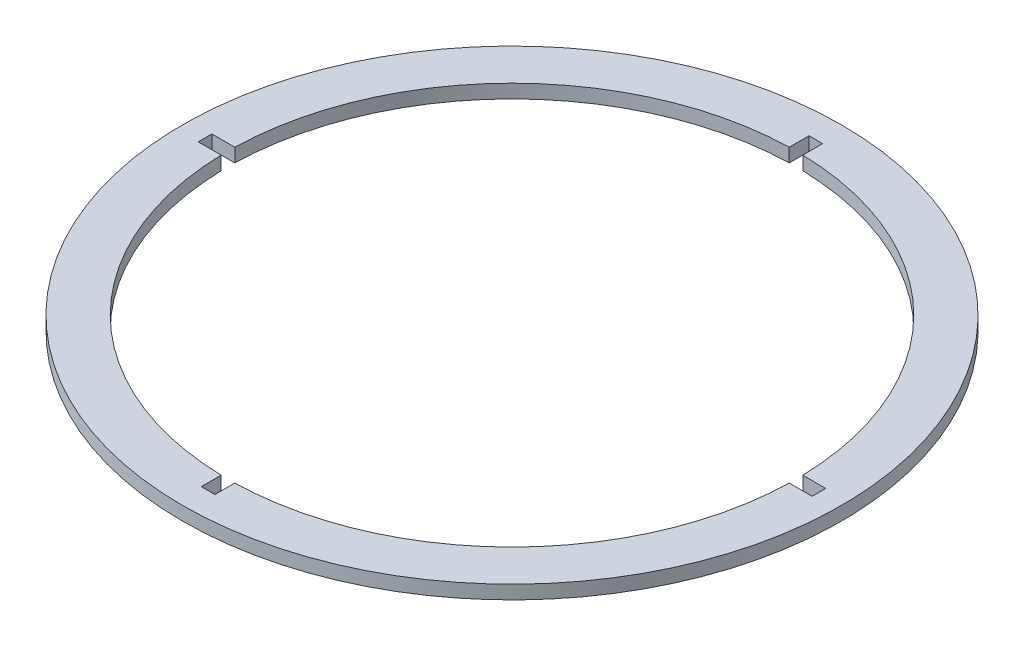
SolidWorks part; units mm, degrees
ref_plane "Front Plane" through (0, 0, 0) normal (0, 0, 1) x (1, 0, 0)
ref_plane "Top Plane" through (0, 0, 0) normal (0, 1, 0) x (1, 0, 0)
ref_plane "Right Plane" through (0, 0, 0) normal (1, 0, 0) x (0, 0, -1)
sketch "Sketch1" plane through (0, 0, 0) normal (0, 1, 0) x (1, 0, 0)
  line L0 (0, 290) -> (0, 250) construction
  line L1 (-290, 0) -> (-270.134, 0) construction
  line L2 (0, 202.7833) -> (0, -250) construction
  line L3 (-6, 202.7833) -> (6, 202.7833)
  line L4 (-6, 249.928) -> (-6, 267.4117)
  line L5 (-6, 267.4117) -> (6, 267.4117)
  line L6 (6, 249.928) -> (6, 267.4117)
  line L7 (6, -249.928) -> (6, -267.4117)
  line L8 (-6, -267.4117) -> (6, -267.4117)
  line L9 (-6, -249.928) -> (-6, -267.4117)
  line L10 (0, -267.4117) -> (0, -297.3843) construction
  line L11 (270.134, 0) -> (290, 0) construction
  line L12 (-249.928, 6) -> (-270.134, 6)
  line L13 (270.134, 6) -> (270.134, -6)
  line L14 (-249.928, -6) -> (-270.134, -6)
  line L15 (-270.134, 6) -> (-270.134, -6)
  line L16 (249.928, -6) -> (270.134, -6)
  line L17 (249.928, 6) -> (270.134, 6)
  arc A0 (-6, 249.928) -> (-249.928, 6) centre (0, 0) ccw
  circle A1 centre (0, 0) radius 290
  circle A2 centre (0, 0) radius 250 construction
  arc A3 (6, -249.928) -> (249.928, -6) centre (0, 0) ccw
  arc A4 (-249.928, -6) -> (-6, -249.928) centre (0, 0) ccw
  arc A5 (249.928, 6) -> (6, 249.928) centre (0, 0) ccw
  dimension "D1" = 500
  dimension "D3" = 6
  dimension "D4" = 12
  dimension "D5" = 6
  dimension "D2" = 40
extrude "Boss-Extrude1" add sketch "Sketch1" along normal blind 12 contours A1 A5 L17 L13 L16 A3 L7 L8 L9 A4 L14 L15 L12 A0 L4 L5 L6
